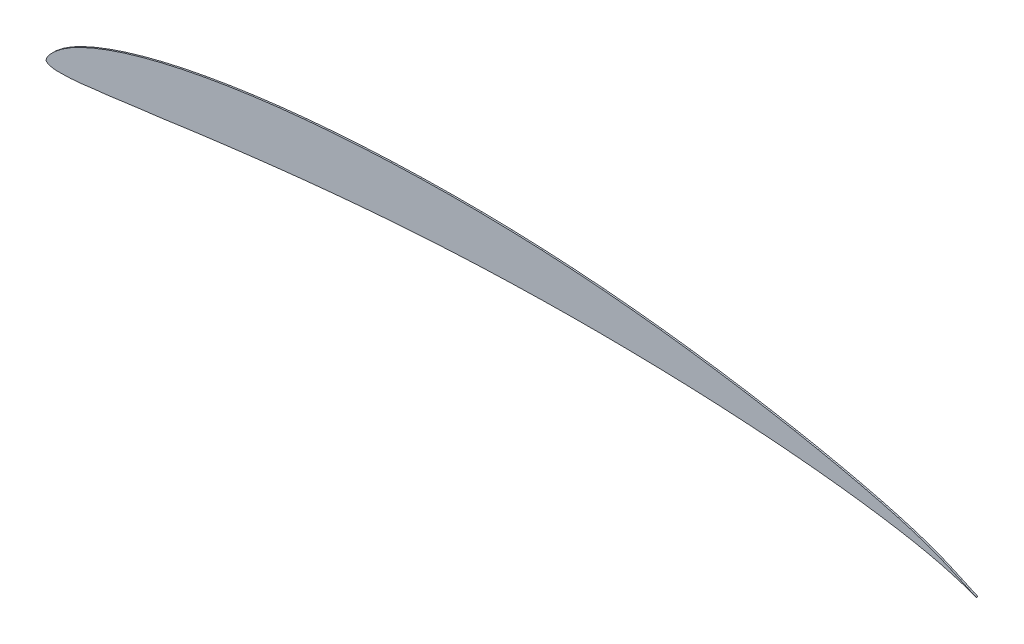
SolidWorks part; units mm, degrees
ref_plane "Ebene vorne" through (0, 0, 0) normal (0, 0, 1) x (1, 0, 0)
ref_plane "Ebene oben" through (0, 0, 0) normal (0, 1, 0) x (1, 0, 0)
ref_plane "Ebene rechts" through (0, 0, 0) normal (1, 0, 0) x (0, 0, -1)
sketch "Skizze1" plane through (0, 0, 0) normal (0, 0, 1) x (1, 0, 0)
  line L50 (-150, 0) -> (-149.8395, 0.51)
  line L51 (-149.8395, 0.51) -> (-149.358, 1.1445)
  line L52 (-149.358, 1.1445) -> (-148.5585, 1.9545)
  line L53 (-148.5585, 1.9545) -> (-147.444, 2.8305)
  line L54 (-147.444, 2.8305) -> (-146.0205, 3.744)
  line L55 (-146.0205, 3.744) -> (-144.291, 4.644)
  line L56 (-144.291, 4.644) -> (-142.266, 5.55)
  line L57 (-142.266, 5.55) -> (-139.9515, 6.4455)
  line L58 (-139.9515, 6.4455) -> (-137.3595, 7.3155)
  line L59 (-137.3595, 7.3155) -> (-134.502, 8.1555)
  line L60 (-134.502, 8.1555) -> (-131.388, 8.955)
  line L61 (-131.388, 8.955) -> (-128.0325, 9.7095)
  line L62 (-128.0325, 9.7095) -> (-124.4505, 10.4115)
  line L63 (-124.4505, 10.4115) -> (-120.657, 11.0565)
  line L64 (-120.657, 11.0565) -> (-116.6685, 11.6415)
  line L65 (-116.6685, 11.6415) -> (-112.5, 12.1605)
  line L66 (-112.5, 12.1605) -> (-108.171, 12.6105)
  line L67 (-108.171, 12.6105) -> (-103.701, 12.99)
  line L68 (-103.701, 12.99) -> (-99.108, 13.2945)
  line L69 (-99.108, 13.2945) -> (-94.4115, 13.524)
  line L70 (-94.4115, 13.524) -> (-89.6325, 13.674)
  line L71 (-89.6325, 13.674) -> (-84.789, 13.746)
  line L72 (-84.789, 13.746) -> (-79.905, 13.737)
  line L73 (-79.905, 13.737) -> (-75, 13.6425)
  line L74 (-75, 13.6425) -> (-70.095, 13.4625)
  line L75 (-70.095, 13.4625) -> (-65.211, 13.194)
  line L76 (-65.211, 13.194) -> (-60.3675, 12.84)
  line L77 (-60.3675, 12.84) -> (-55.5885, 12.405)
  line L78 (-55.5885, 12.405) -> (-50.892, 11.8995)
  line L79 (-50.892, 11.8995) -> (-46.299, 11.3295)
  line L80 (-46.299, 11.3295) -> (-41.829, 10.7085)
  line L81 (-41.829, 10.7085) -> (-37.5, 10.047)
  line L82 (-37.5, 10.047) -> (-33.3315, 9.3525)
  line L83 (-33.3315, 9.3525) -> (-29.343, 8.6295)
  line L84 (-29.343, 8.6295) -> (-25.5495, 7.887)
  line L85 (-25.5495, 7.887) -> (-21.9675, 7.131)
  line L86 (-21.9675, 7.131) -> (-18.612, 6.366)
  line L87 (-18.612, 6.366) -> (-15.498, 5.5995)
  line L88 (-15.498, 5.5995) -> (-12.6405, 4.836)
  line L89 (-12.6405, 4.836) -> (-10.0485, 4.0725)
  line L90 (-10.0485, 4.0725) -> (-7.734, 3.3015)
  line L91 (-7.734, 3.3015) -> (-5.709, 2.532)
  line L92 (-5.709, 2.532) -> (-3.9795, 1.797)
  line L93 (-3.9795, 1.797) -> (-2.556, 1.1505)
  line L94 (-2.556, 1.1505) -> (-1.4415, 0.636)
  line L95 (-1.4415, 0.636) -> (-0.642, 0.2745)
  line L96 (-0.642, 0.2745) -> (-0.1605, 0.0675)
  line L97 (-0.1605, 0.0675) -> (0, 0)
  line L98 (-150, 0) -> (-149.8395, -0.225)
  line L99 (-149.8395, -0.225) -> (-149.358, -0.45)
  line L100 (-149.358, -0.45) -> (-148.5585, -0.6)
  line L101 (-148.5585, -0.6) -> (-147.444, -0.6)
  line L102 (-147.444, -0.6) -> (-146.0205, -0.555)
  line L103 (-146.0205, -0.555) -> (-144.291, -0.405)
  line L104 (-144.291, -0.405) -> (-142.266, -0.15)
  line L105 (-142.266, -0.15) -> (-139.9515, 0.105)
  line L106 (-139.9515, 0.105) -> (-137.3595, 0.462)
  line L107 (-137.3595, 0.462) -> (-134.502, 0.8415)
  line L108 (-134.502, 0.8415) -> (-131.388, 1.2285)
  line L109 (-131.388, 1.2285) -> (-128.0325, 1.7055)
  line L110 (-128.0325, 1.7055) -> (-124.4505, 2.1915)
  line L111 (-124.4505, 2.1915) -> (-120.657, 2.673)
  line L112 (-120.657, 2.673) -> (-116.6685, 3.1635)
  line L113 (-116.6685, 3.1635) -> (-112.5, 3.6495)
  line L114 (-112.5, 3.6495) -> (-108.171, 4.119)
  line L115 (-108.171, 4.119) -> (-103.701, 4.5675)
  line L116 (-103.701, 4.5675) -> (-99.108, 4.986)
  line L117 (-99.108, 4.986) -> (-94.4115, 5.367)
  line L118 (-94.4115, 5.367) -> (-89.6325, 5.7015)
  line L119 (-89.6325, 5.7015) -> (-84.789, 5.9835)
  line L120 (-84.789, 5.9835) -> (-79.905, 6.21)
  line L121 (-79.905, 6.21) -> (-75, 6.3795)
  line L122 (-75, 6.3795) -> (-70.095, 6.495)
  line L123 (-70.095, 6.495) -> (-65.211, 6.5565)
  line L124 (-65.211, 6.5565) -> (-60.3675, 6.564)
  line L125 (-60.3675, 6.564) -> (-55.5885, 6.519)
  line L126 (-55.5885, 6.519) -> (-50.892, 6.4215)
  line L127 (-50.892, 6.4215) -> (-46.299, 6.273)
  line L128 (-46.299, 6.273) -> (-41.829, 6.0795)
  line L129 (-41.829, 6.0795) -> (-37.5, 5.838)
  line L130 (-37.5, 5.838) -> (-33.3315, 5.5545)
  line L131 (-33.3315, 5.5545) -> (-29.343, 5.232)
  line L132 (-29.343, 5.232) -> (-25.5495, 4.875)
  line L133 (-25.5495, 4.875) -> (-21.9675, 4.4835)
  line L134 (-21.9675, 4.4835) -> (-18.612, 4.0665)
  line L135 (-18.612, 4.0665) -> (-15.498, 3.6285)
  line L136 (-15.498, 3.6285) -> (-12.6405, 3.1755)
  line L137 (-12.6405, 3.1755) -> (-10.0485, 2.7075)
  line L138 (-10.0485, 2.7075) -> (-7.734, 2.2305)
  line L139 (-7.734, 2.2305) -> (-5.709, 1.752)
  line L140 (-5.709, 1.752) -> (-3.9795, 1.2855)
  line L141 (-3.9795, 1.2855) -> (-2.556, 0.858)
  line L142 (-2.556, 0.858) -> (-1.4415, 0.495)
  line L143 (-1.4415, 0.495) -> (-0.642, 0.2235)
  line L144 (-0.642, 0.2235) -> (-0.1605, 0.0555)
  line L145 (-0.1605, 0.0555) -> (0, 0)
extrude "Linear austragen1" add sketch "Skizze1" along normal mid plane 0.25
